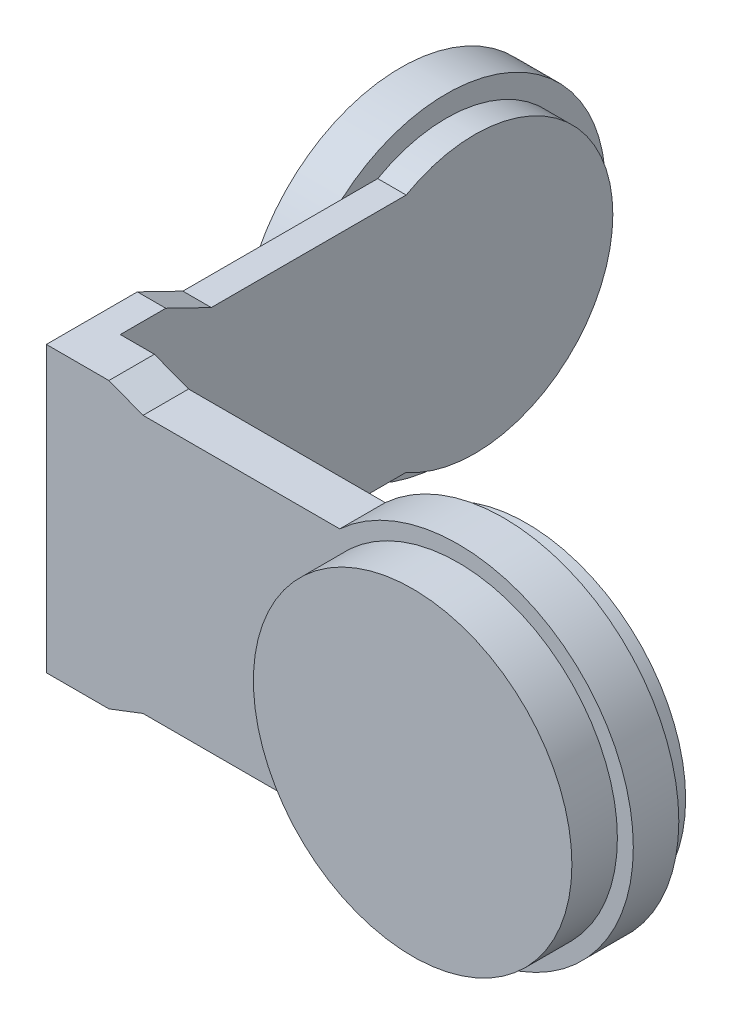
SolidWorks part; units mm, degrees
ref_plane "Front Plane" through (0, 0, 0) normal (0, 0, 1) x (1, 0, 0)
ref_plane "Top Plane" through (0, 0, 0) normal (0, 1, 0) x (1, 0, 0)
ref_plane "Right Plane" through (0, 0, 0) normal (1, 0, 0) x (0, 0, -1)
sketch "Sketch2" plane through (0, 0, 0) normal (1, 0, 0) x (0, 0, -1)
  circle A0 centre (0, 0) radius 14
extrude "Boss-Extrude1" add sketch "Sketch2" along normal blind 4
sketch "Sketch3" plane through (4, 0, 0) normal (1, 0, 0) x (0, 0, -1)
  line L0 (12.15, 0) -> (-35.15, 0) construction
  line L1 (-35.15, 12.5) -> (-35.15, -12.5)
  line L2 (-35.15, -12.5) -> (-27.15, -12.5)
  line L3 (-27.15, -12.5) -> (-23.15, -10.5553)
  line L4 (-23.15, -10.5553) -> (-6.0174, -10.5553)
  line L5 (-35.15, 12.5) -> (-27.15, 12.5)
  line L6 (-27.15, 12.5) -> (-23.15, 10.5553)
  line L7 (-23.15, 10.5553) -> (-6.0174, 10.5553)
  arc A0 (-6.0174, -10.5553) -> (-6.0174, 10.5553) centre (0, 0) ccw
  dimension "D1" = 24.3
  dimension "D2" = 47.3
  dimension "D3" = 12.5
  dimension "D4" = 12
  dimension "D5" = 8
extrude "Boss-Extrude2" add sketch "Sketch3" along normal blind 2.5
sketch "Sketch4" plane through (0, 0, 35.15) normal (0, 0, 1) x (1, 0, 0)
  line L0 (6.5, 0) -> (55.6, 0) construction
  line L1 (6.5, 12.5) -> (6.5, -12.5) construction
  line L2 (12.5, -11.35) -> (29.7915, -11.35)
  line L3 (12.5, 11.35) -> (29.7915, 11.35)
  line L4 (6.5, -12.5) -> (9.5, -12.5)
  line L5 (9.5, -12.5) -> (12.5, -11.35)
  line L6 (6.5, 12.5) -> (9.5, 12.5)
  line L7 (9.5, 12.5) -> (12.5, 11.35)
  line L8 (6.5, 12.5) -> (6.5, -12.5)
  arc A0 (29.7915, -11.35) -> (29.7915, 11.35) centre (40.2, 0) ccw
  dimension "D2" = 30.8
  dimension "D1" = 49.1
  dimension "D3" = 11.35
  dimension "D4" = 3
  dimension "D5" = 6
extrude "Boss-Extrude3" add sketch "Sketch4" against normal blind 4
sketch "Sketch5" plane through (0, 0, 35.15) normal (0, 0, 1) x (1, 0, 0)
  circle A0 centre (40.2, 0) radius 14
  arc A1 (29.7915, -11.35) -> (29.7915, 11.35) centre (40.2, 0) ccw construction
extrude "Boss-Extrude4" add sketch "Sketch5" along normal blind 4
sketch "Sketch6" plane through (0, 0, 31.15) normal (0, 0, -1) x (-1, 0, 0)
  circle A0 centre (-40.2, 0) radius 14
  arc A1 (-29.7915, 11.35) -> (-29.7915, -11.35) centre (-40.2, 0) ccw construction
extrude "Boss-Extrude5" add sketch "Sketch6" along normal blind 2
